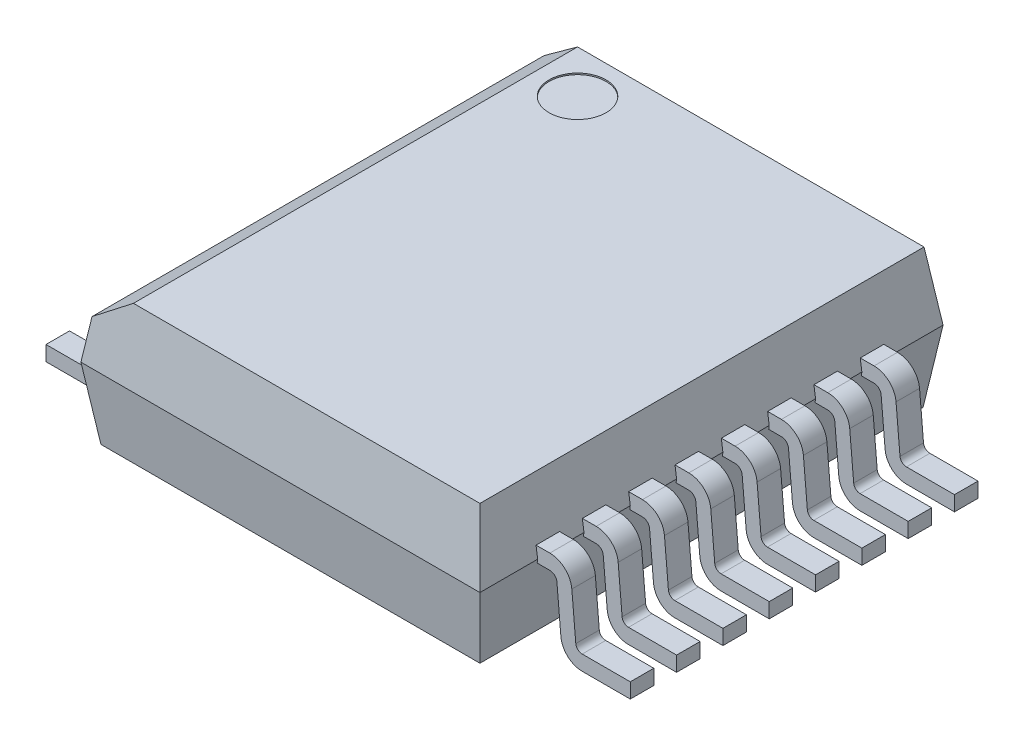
SolidWorks part; units mm, degrees
ref_plane "Front" through (0, 0, 0) normal (0, 0, 1) x (1, 0, 0)
ref_plane "Top" through (0, 0, 0) normal (0, 1, 0) x (1, 0, 0)
ref_plane "Right" through (0, 0, 0) normal (1, 0, 0) x (0, 0, -1)
ref_plane "ПлоскостьВывод1" through (0, 0, -2.275) normal (0, 0, 1) x (1, 0, 0)
sketch "ЭскизВывод1" plane through (0, 0, -2.275) normal (0, 0, 1) x (1, 0, 0)
  line L0 (-4.1, 0) -> (-3.4249, 0)
  line L1 (-3.126, 0.2739) -> (-3.0705, 0.9087)
  line L2 (-2.9709, 1) -> (2.9709, 1)
  line L3 (0, 1) -> (0, 0) construction
  line L4 (3.126, 0.2739) -> (3.0705, 0.9087)
  line L5 (4.1, 0) -> (3.4249, 0)
  arc A0 (-3.0705, 0.9087) -> (-2.9709, 1) centre (-2.9709, 0.9) cw
  arc A1 (-3.4249, 0) -> (-3.126, 0.2739) centre (-3.4249, 0.3) ccw
  arc A2 (3.4249, 0) -> (3.126, 0.2739) centre (3.4249, 0.3) cw
  arc A3 (3.0705, 0.9087) -> (2.9709, 1) centre (2.9709, 0.9) ccw
  point P8 (-3.0625, 1)
  point P11 (-3.15, 0)
  dimension "D6" = 0.1
  dimension "D7" = 0.3
  dimension "E" = 8.2
  dimension "A_mid_lead" = 1
  dimension "L" = 0.95
  dimension "D4" = 85
  dimension "D5" = 6.125
extrude "Вывод1" add sketch "ЭскизВывод1" along normal mid plane 0.33 thin
ref_plane "ПлоскостьКорпус" through (0, 1.05, 0) normal (0, 1, 0) x (-1, 0, 0)
sketch "ЭскизКорпус" plane through (0, 1.05, 0) normal (0, 1, 0) x (1, 0, 0)
  line L1 (2.8, -3.25) -> (-2.8, -3.25)
  line L2 (2.8, -3.25) -> (2.8, 3.25)
  line L3 (2.8, 3.25) -> (-2.8, 3.25)
  line L4 (-2.8, -3.25) -> (-2.8, 3.25)
  line L5 (2.8, -3.25) -> (-2.8, 3.25) construction
  line L6 (2.8, 3.25) -> (-2.8, -3.25) construction
  point P0 (0, 0)
  dimension "D" = 6.5
  dimension "E" = 5.6
extrude "Корпус" add sketch "ЭскизКорпус" along normal offset from surface 2 draft 8 and the other way offset from surface (1 mm away) 0.05 draft 8
pattern_linear "Выводы" count 8 spacing 0.65 along (0, 0, 1) of "Вывод1"
chamfer "Фаска1" distance 0.4 angle 45 1 edges at (-2.6665, 2, 0)
sketch "Эскиз3" plane through (0, 2, 0) normal (0, 1, 0) x (1, 0, 0)
  line L0 (-2.1965, 2.5165) -> (-1.5965, 2.5165) construction
  line L1 (-2.1965, 3.1165) -> (-2.1965, -3.1165) construction
  line L2 (-1.5965, 2.5165) -> (-1.5965, 3.1165) construction
  line L3 (2.6665, 3.1165) -> (-2.1965, 3.1165) construction
  circle A0 centre (-1.5965, 2.5165) radius 0.4
  dimension "D2" = 0.8
  dimension "D1" = 0.6
extrude "Вытянуть3" cut sketch "Эскиз3" against normal blind 0.02
sketch "SkThermalPad" plane through (0, 1.05, 0) normal (0, 1, 0) x (-1, 0, 0)
  line L1 (1.25, 1.25) -> (-1.25, 1.25)
  line L2 (1.25, 1.25) -> (1.25, -1.25)
  line L3 (1.25, -1.25) -> (-1.25, -1.25)
  line L4 (-1.25, 1.25) -> (-1.25, -1.25)
  line L5 (1.25, 1.25) -> (-1.25, -1.25) construction
  line L6 (1.25, -1.25) -> (-1.25, 1.25) construction
  point P0 (0, 0)
  dimension "D1" = 2.5
  dimension "E2" = 2.5
extrude "ThermalPad" [suppressed] add sketch "SkThermalPad" against normal up to surface (0.95 mm away)
